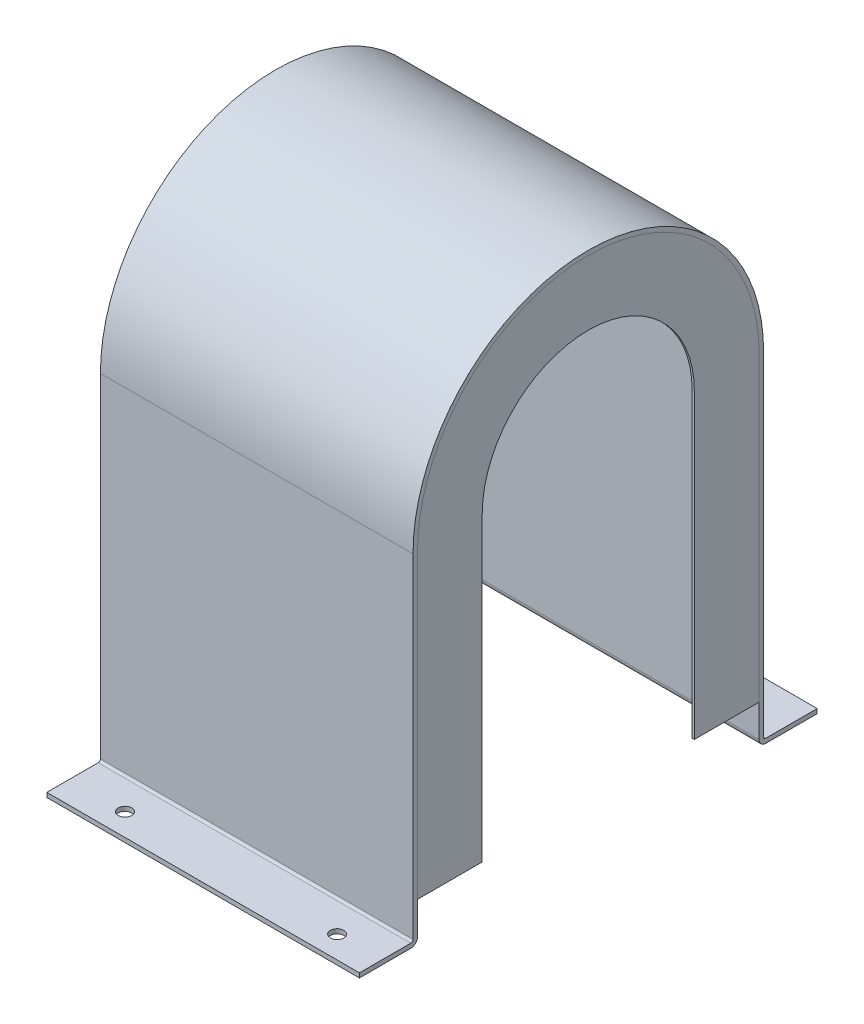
SolidWorks part; units mm, degrees
ref_plane "Front Plane" through (0, 0, 0) normal (0, 0, 1) x (1, 0, 0)
ref_plane "Top Plane" through (0, 0, 0) normal (0, 1, 0) x (1, 0, 0)
ref_plane "Right Plane" through (0, 0, 0) normal (1, 0, 0) x (0, 0, -1)
sketch "Sketch1" plane through (0, 0, 0) normal (1, 0, 0) x (0, 0, -1)
  line L0 (157, 0) -> (157, -299)
  line L1 (159, -301) -> (205, -301)
  line L2 (-157, 0) -> (-157, -299)
  line L3 (-159, -301) -> (-205, -301)
  line L4 (159, -305) -> (205, -305)
  line L5 (153, 0) -> (153, -299)
  line L6 (-153, 0) -> (-153, -299)
  line L7 (-159, -305) -> (-205, -305)
  line L8 (-205, -301) -> (-205, -305)
  line L9 (205, -301) -> (205, -305)
  arc A0 (157, 0) -> (-157, 0) centre (0, 0) ccw
  arc A1 (157, -299) -> (159, -301) centre (159, -299) ccw
  arc A2 (-157, -299) -> (-159, -301) centre (-159, -299) cw
  arc A3 (153, -299) -> (159, -305) centre (159, -299) ccw
  arc A4 (153, 0) -> (-153, 0) centre (0, 0) ccw
  arc A5 (-153, -299) -> (-159, -305) centre (-159, -299) cw
  arc A6 (157, 0) -> (-157, 0) centre (0, 0) ccw construction
  point P15 (-157, -301)
  dimension "D1" = 314
  dimension "D4" = 2
  dimension "D2" = 462
  dimension "D3" = 48
  dimension "D5" = 4
extrude "Boss-Extrude1" add sketch "Sketch1" along normal mid plane 280 contours A0 L2 A2 L3 L8 L7 A5 L6 A4 L5 A3 L4 L9 L1 A1 L0
sketch "Sketch2" plane through (140, 0, 0) normal (1, 0, 0) x (0, 0, -1)
  line L0 (-153, 0) -> (-153, -270)
  line L2 (-153, -270) -> (153, -270)
  line L4 (153, -270) -> (153, 0)
  line L5 (-153, 0) -> (-153, -299) construction
  line L6 (153, 0) -> (153, -299) construction
  line L7 (159, -305) -> (205, -305) construction
  arc A0 (-153, 0) -> (153, 0) centre (0, 0) cw
  arc A2 (153, 0) -> (-153, 0) centre (0, 0) ccw construction
  circle A3 centre (0, 0) radius 95
  dimension "D1" = 35
  dimension "D2" = 190
extrude "Boss-Extrude2" add sketch "Sketch2" against normal blind 2 separate body contours L2 L4 A0 L0 | A3
mirror "Mirror4" about plane through (0, 0, 0) normal (1, 0, 0)
sketch "Sketch3" plane through (0, -301, 0) normal (0, 1, 0) x (1, 0, 0)
  line L0 (100, -185) -> (-90, -185) construction
  line L2 (140, -205) -> (-140, -205) construction
  circle A0 centre (-90, -185) radius 6
  circle A1 centre (100, -185) radius 6
  dimension "D1" = 12
  dimension "D2" = 20
  dimension "D3" = 190
  dimension "D4" = 50
extrude "Cut-Extrude1" cut sketch "Sketch3" against normal through all
mirror "Mirror5" about plane through (0, 0, 0) normal (0, 0, 1) of "Cut-Extrude1"
sketch "Sketch4" plane through (-140, 0, 0) normal (-1, 0, 0) x (0, 0, 1)
  line L0 (95, 0) -> (95, -270)
  line L1 (153, -270) -> (-153, -270) construction
  line L2 (95, -270) -> (-95, -270)
  line L3 (-95, -270) -> (-95, 0)
  line L4 (-95, 0) -> (95, 0)
  circle A0 centre (0, 0) radius 95 construction
  dimension "D1" = 190
extrude "Cut-Extrude2" cut sketch "Sketch4" against normal through all
